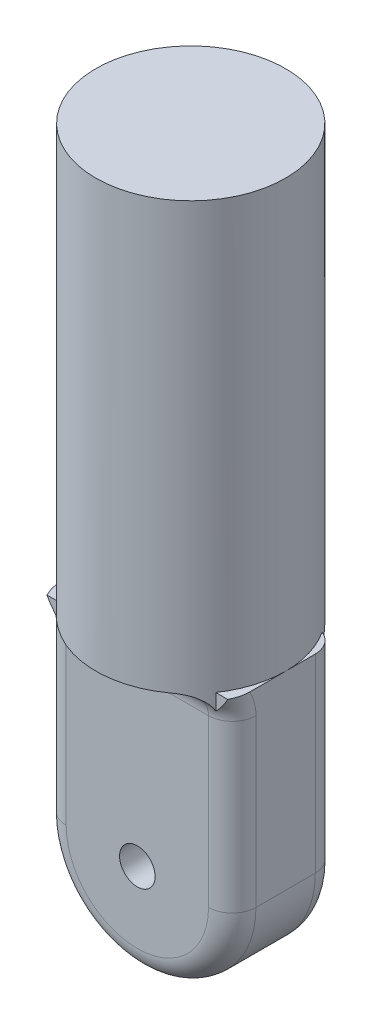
SolidWorks part; units mm, degrees
ref_plane "Front Plane" through (0, 0, 0) normal (0, 0, 1) x (1, 0, 0)
ref_plane "Top Plane" through (0, 0, 0) normal (0, 1, 0) x (1, 0, 0)
ref_plane "Right Plane" through (0, 0, 0) normal (1, 0, 0) x (0, 0, -1)
sketch "Sketch1" plane through (0, 0, 0) normal (0, 0, 1) x (1, 0, 0)
  line L2 (-25.4, 0) -> (-25.4, 50.8)
  line L3 (-25.4, 50.8) -> (25.4, 50.8)
  line L4 (25.4, 0) -> (25.4, 50.8)
  arc A0 (-25.4, 0) -> (25.4, 0) centre (0, 0) ccw
  dimension "D1" = 50.8
  dimension "D2" = 50.8
extrude "Boss-Extrude1" add sketch "Sketch1" along normal mid plane 28.575
sketch "Sketch8" plane through (0, 0, 14.2875) normal (0, 0, 1) x (1, 0, 0)
  circle A0 centre (0, 0) radius 4.7625
  dimension "D1" = 9.525
extrude "Cut-Extrude1" cut sketch "Sketch8" against normal through all
sketch "Sketch9" plane through (0, 50.8, 0) normal (0, 1, 0) x (1, 0, 0)
  circle A0 centre (0, 0) radius 25.4
  dimension "D1" = 50.8
extrude "Boss-Extrude2" add sketch "Sketch9" along normal blind 114.3
fillet "Fillet1" radius 6.35 1 edges at (0, 50.8, 14.2875)
fillet "Fillet3" radius 6.35 3 edges at (25.4, 25.4, 14.2875) (0, -25.4, 14.2875) (-25.4, 25.4, 14.2875)
fillet "Fillet4" radius 6.35 3 edges at (25.4, 25.4, -14.2875) (0, -25.4, -14.2875) (-25.4, 25.4, -14.2875)
fillet "Fillet5" radius 6.35 3 edges at (20.1764, 50.8, -14.1868) (-20.1764, 50.8, -14.1868) (0, 50.8, -14.2875)
sketch "Sketch10" plane through (0, 0, 0) normal (0, 0, 1) x (1, 0, 0)
  point P0 (0, 0)
